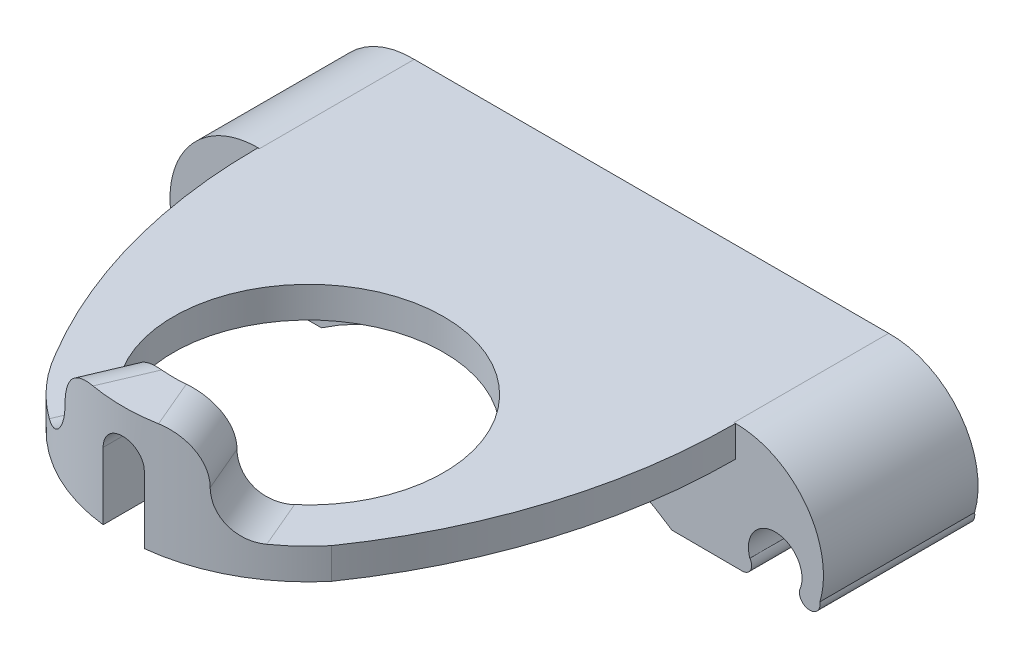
SolidWorks part; units mm, degrees
ref_plane "Спереди" through (0, 0, 0) normal (0, 0, 1) x (1, 0, 0)
ref_plane "Сверху" through (0, 0, 0) normal (0, 1, 0) x (1, 0, 0)
ref_plane "Справа" through (0, 0, 0) normal (1, 0, 0) x (0, 0, -1)
sketch "Эскиз1" plane through (0, 0, 0) normal (0, 0, 1) x (1, 0, 0)
  line L0 (-48.7532, 0) -> (-55.5749, -0.0256)
  line L1 (-31.7671, 17.1838) -> (-31.7671, -1.86) construction
  line L2 (-54.7671, 12.0369) -> (-8.7671, 12.0369)
  line L3 (-14.781, 0) -> (-7.9593, -0.0256)
  arc A0 (-55.5749, -0.0256) -> (-56.3098, 1.4127) centre (-55.5783, 0.8796) cw
  arc A1 (-48.7532, 0) -> (-14.781, 0) centre (-31.7671, -24.9703) cw
  arc A2 (-56.3098, 1.4127) -> (-61.2237, 1.4107) centre (-58.7671, 2.2623) ccw
  arc A3 (-61.2237, 1.4107) -> (-63.0957, 1.1525) centre (-62.115, 0.9573) cw
  arc A4 (-63.0957, 1.1525) -> (-54.7671, 12.0369) centre (-54.9375, 3.5386) cw
  arc A5 (-0.4385, 1.1525) -> (-8.7671, 12.0369) centre (-8.5967, 3.5386) ccw
  arc A6 (-2.3105, 1.4107) -> (-0.4385, 1.1525) centre (-1.4192, 0.9573) ccw
  arc A7 (-7.2244, 1.4127) -> (-2.3105, 1.4107) centre (-4.7671, 2.2623) cw
  arc A8 (-7.9593, -0.0256) -> (-7.2244, 1.4127) centre (-7.9559, 0.8796) ccw
  point P31 (-31.7671, 12.0369)
  dimension "D1" = 30.2
  dimension "D3" = 2.6
  dimension "D4" = 1
  dimension "D6" = 8.5
  dimension "D2" = 54
  dimension "D5" = 46
  dimension "D7" = 6.8217
extrude "Бобышка-Вытянуть1" add sketch "Эскиз1" along normal blind 15
sketch "Эскиз2" plane through (0, 12.0369, 0) normal (0, -1, 0) x (1, 0, 0)
  line L0 (-54.9144, 15) -> (-8.6198, 15)
  line L1 (-31.7671, 15) -> (-31.7671, 0) construction
  line L2 (-14.781, 15) -> (-48.7532, 15) construction
  line L3 (-48.7532, 0) -> (-14.781, 0) construction
  circle A0 centre (-31.7382, 33.271) radius 13.1
  arc A1 (-17.9569, 44.8509) -> (-47.4533, 42.0489) centre (-31.7382, 33.271) ccw
  arc A2 (-8.6198, 15) -> (-17.9569, 44.8509) centre (-61.005, 15) ccw
  arc A3 (-54.9144, 15) -> (-47.4533, 42.0489) centre (-2.1534, 15) cw
  dimension "D2" = 18.0005
  dimension "D1" = 26.2
  dimension "D3" = 52.7611
  dimension "D4" = 52.3852
  dimension "D5" = 18.271
extrude "Бобышка-Вытянуть2" add sketch "Эскиз2" along normal blind 3
sketch "Эскиз3" plane through (0, 12.0369, 0) normal (0, 1, 0) x (1, 0, 0)
  line L0 (-31.7382, -46.371) -> (-31.7382, -51.2715) construction
  line L1 (-36.8577, -45.3292) -> (-38.7728, -49.84)
  line L2 (-26.6187, -45.3292) -> (-24.7036, -49.84)
  arc A0 (-36.8577, -45.3292) -> (-26.6187, -45.3292) centre (-31.7382, -33.271) ccw
  arc A1 (-38.7728, -49.84) -> (-24.7036, -49.84) centre (-31.7382, -33.271) ccw
  circle A2 centre (-31.7382, -33.271) radius 13.1 construction
  arc A3 (-47.4533, -42.0489) -> (-17.9569, -44.8509) centre (-31.7382, -33.271) ccw construction
  point P5 (0, 0)
  dimension "D1" = 10.2389
extrude "Бобышка-Вытянуть3" add sketch "Эскиз3" along normal blind 8
fillet "Скругление1" radius 4 4 edges at (-25.6612, 12.0369, 47.5846) (-25.6612, 20.0369, 47.5846) (-37.8152, 12.0369, 47.5846) (-37.8152, 20.0369, 47.5846)
ref_plane "Плоскость5" through (0, 0, 25) normal (0, 0, 1) x (1, 0, 0)
sketch "Эскиз4" plane through (0, 0, 25) normal (0, 0, 1) x (1, 0, 0)
  line L0 (-31.7671, 9.0369) -> (-31.7671, 26.1069) construction
  line L1 (-54.9144, 9.0369) -> (-8.6198, 9.0369) construction
  line L3 (-34.915, 20.0369) -> (-28.5614, 20.0369) construction
  line L4 (-33.7671, 15.5369) -> (-33.7671, 6.9649)
  line L5 (-33.7671, 6.9649) -> (-29.7671, 6.9649)
  line L6 (-29.7671, 6.9649) -> (-29.7671, 15.5369)
  arc A0 (-29.7671, 15.5369) -> (-33.7671, 15.5369) centre (-31.7671, 15.5369) ccw
  dimension "D1" = 4
  dimension "D2" = 4.5
extrude "Вырез-Вытянуть1" cut sketch "Эскиз4" along normal through all
